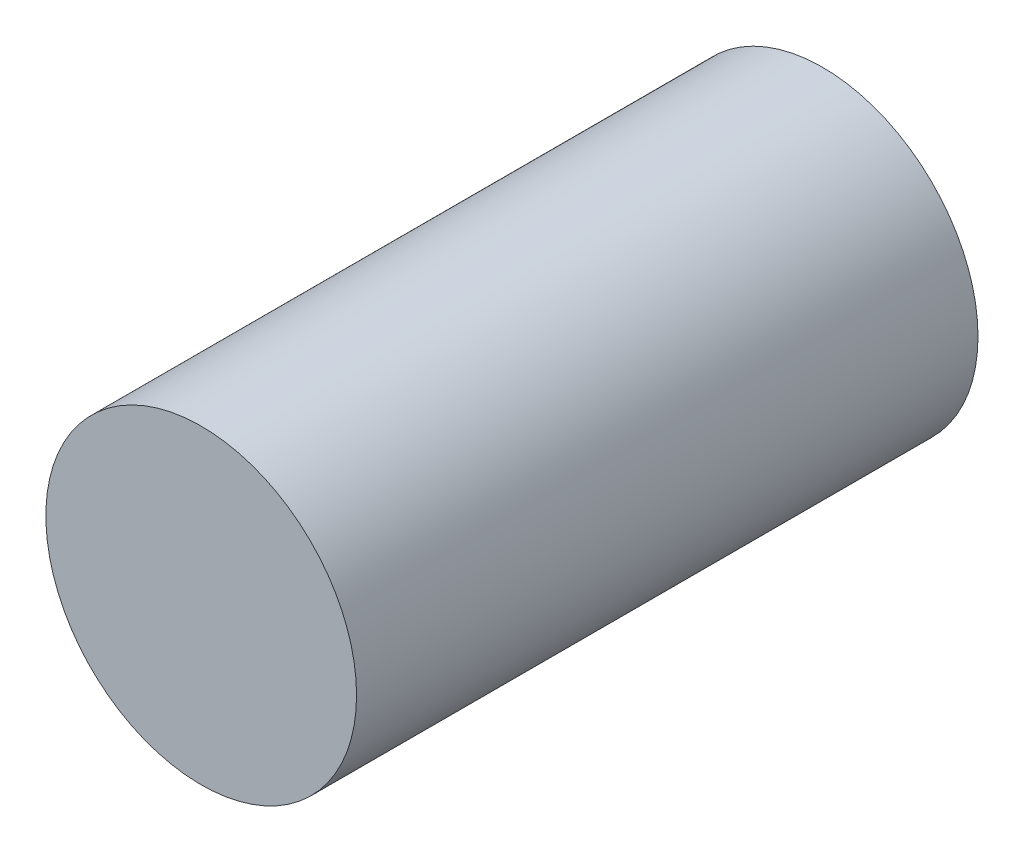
SolidWorks part; units mm, degrees
ref_plane "Front Plane" through (0, 0, 0) normal (0, 0, 1) x (1, 0, 0)
ref_plane "Top Plane" through (0, 0, 0) normal (0, 1, 0) x (1, 0, 0)
ref_plane "Right Plane" through (0, 0, 0) normal (1, 0, 0) x (0, 0, -1)
sketch "Sketch1" plane through (0, 0, 0) normal (0, 0, 1) x (1, 0, 0)
sketch_block_instance "Block-Shaft-1"
sketch_block "Block-Shaft" parameters "D1"=5
extrude "Boss-Extrude1" add sketch "Sketch1" against normal blind 10
